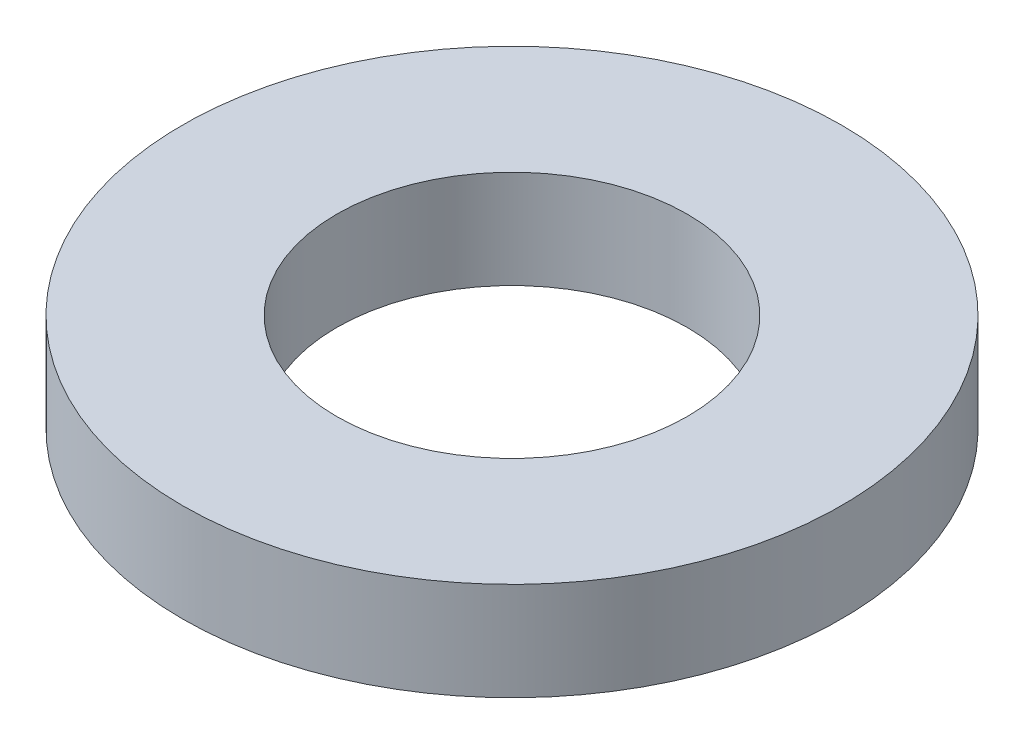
SolidWorks part; units mm, degrees
ref_plane "Plan de face" through (0, 0, 0) normal (0, 0, 1) x (1, 0, 0)
ref_plane "Plan de dessus" through (0, 0, 0) normal (0, 1, 0) x (1, 0, 0)
ref_plane "Plan de droite" through (0, 0, 0) normal (1, 0, 0) x (0, 0, -1)
sketch "Esquisse1" plane through (0, 0, 0) normal (0, 1, 0) x (1, 0, 0)
  circle A0 centre (0, 0) radius 23.5
  circle A1 centre (0, 0) radius 12.5
  dimension "D1" = 25
  dimension "D2" = 47
extrude "Extrusion1" add sketch "Esquisse1" against normal blind 7
